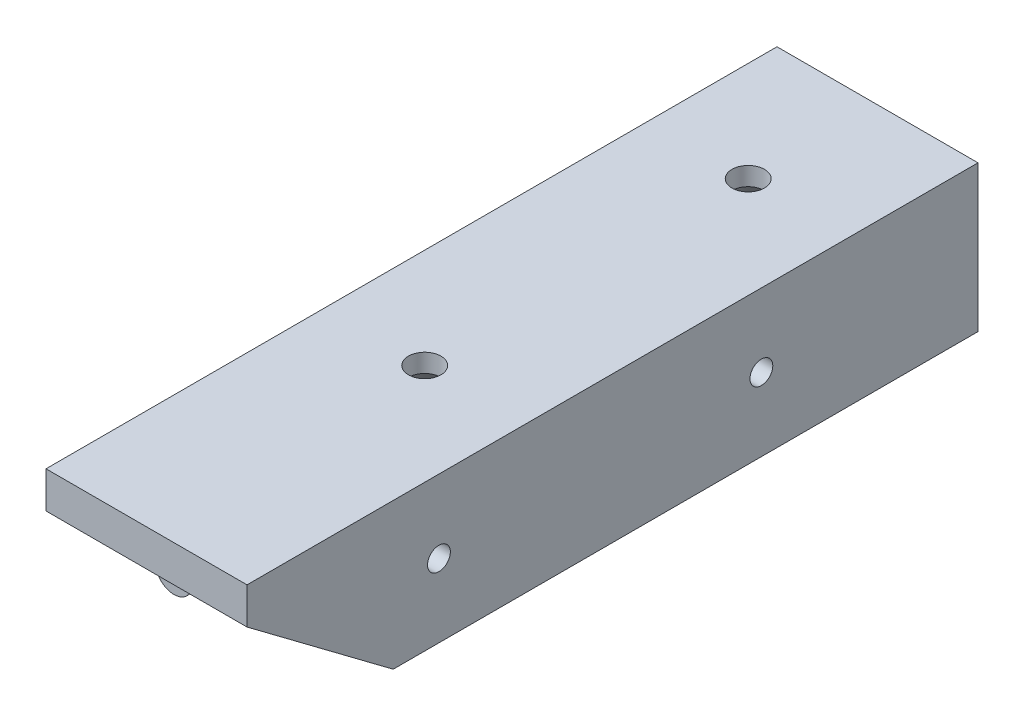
SolidWorks part; units mm, degrees
ref_plane "Front Plane" through (0, 0, 0) normal (0, 0, 1) x (1, 0, 0)
ref_plane "Top Plane" through (0, 0, 0) normal (0, 1, 0) x (1, 0, 0)
ref_plane "Right Plane" through (0, 0, 0) normal (1, 0, 0) x (0, 0, -1)
sketch "Sketch1" plane through (0, 0, 0) normal (0, 0, 1) x (1, 0, 0)
  line L0 (-33.5034, -0.7828) -> (-33.5034, 7.2172)
  line L1 (-33.5034, 7.2172) -> (-22.5034, 7.2172)
  line L2 (-22.5034, 7.2172) -> (-22.5034, -0.7828)
  line L3 (-31.5034, -0.7828) -> (-31.5034, 5.2172)
  line L4 (-31.5034, 5.2172) -> (-24.5034, 5.2172)
  line L5 (-24.5034, 5.2172) -> (-24.5034, -0.7828)
  line L6 (-33.5034, -0.7828) -> (-31.5034, -0.7828)
  line L7 (-24.5034, -0.7828) -> (-22.5034, -0.7828)
  dimension "D1" = 11
  dimension "D2" = 8
  dimension "D3" = 8
  dimension "D4" = 2
extrude "Boss-Extrude1" add sketch "Sketch1" along normal blind 40
sketch "Sketch3" plane through (-22.5034, 0, 0) normal (1, 0, 0) x (0, 0, -1)
  line L0 (-40, 7.2172) -> (-40, 5.2172) construction
  line L1 (-40, -0.7828) -> (-40, 7.2172) construction
  line L2 (-40, 5.2172) -> (-32, -0.7828) construction
  line L3 (-40, -0.7828) -> (0, -0.7828) construction
  line L4 (-40, 5.2172) -> (-40, -0.7828)
  line L5 (-40, -0.7828) -> (-32, -0.7828)
  line L6 (-32, -0.7828) -> (-40, 5.2172)
  line L7 (-40, 5.2172) -> (-29.9422, 5.1842)
  dimension "D1" = 2
  dimension "D2" = 10
extrude "Cut-Extrude1" cut sketch "Sketch3" against normal blind 15 contours L6 M6 M5
sketch "Sketch4" plane through (-22.5034, 0, 0) normal (1, 0, 0) x (0, 0, -1)
  line L0 (-30.5205, 3.2172) -> (-29.4974, 3.2172) construction
  line L1 (0, -0.7828) -> (0, 7.2172) construction
  line L2 (-32, -0.7828) -> (-40, 5.2172) construction
  line L3 (-37.3333, 3.2172) -> (-23.7077, 3.2172) construction
  line L4 (-23.7077, 3.2172) -> (0, 3.2172) construction
  circle A0 centre (-29.4974, 3.2172) radius 0.625
  circle A1 centre (-11.8539, 3.2172) radius 0.625
  dimension "D1" = 1.25
  dimension "D2" = 1.25
extrude "Cut-Extrude6" cut sketch "Sketch4" against normal blind 2
sketch "Sketch5" plane through (-33.5034, 0, 0) normal (-1, 0, 0) x (0, 0, 1)
  line L0 (30.5392, 3.2172) -> (29.4697, 3.2172) construction
  line L1 (0, 7.2172) -> (0, -0.7828) construction
  line L2 (32, -0.7828) -> (40, 5.2172) construction
  line L3 (37.3333, 3.2172) -> (23.745, 3.2172) construction
  line L4 (23.745, 3.2172) -> (0, 3.2172) construction
  circle A0 centre (11.8725, 3.2172) radius 0.625
  circle A1 centre (29.4697, 3.2172) radius 0.625
  dimension "D1" = 1.25
  dimension "D3" = 1.25
extrude "Cut-Extrude3" cut sketch "Sketch5" against normal blind 3
sketch "Sketch8" plane through (0, 5.2172, 0) normal (0, -1, 0) x (-1, 0, 0)
  circle A0 centre (28.0381, -7.0405) radius 2.5
  circle A1 centre (28.0381, -24.7423) radius 2.5
  point P7 (28.0381, -7.0405)
  dimension "D3" = 5
  dimension "D4" = 5
sketch "Sketch9" plane through (0, 5.2172, 0) normal (0, -1, 0) x (-1, 0, 0)
  line L2 (28.0034, -40) -> (28.0034, -38) construction
  line L3 (27.0034, -20) -> (29.0034, -20)
  line L4 (27.0034, -20) -> (27.0034, -21)
  line L5 (27.0034, -21) -> (29.0034, -21)
  line L6 (29.0034, -20) -> (29.0034, -21)
  line L7 (27.0034, -20) -> (29.0034, -21) construction
  line L8 (27.0034, -21) -> (29.0034, -20) construction
  line L9 (31.5034, -40) -> (24.5034, -40) construction
  line L10 (28.0034, -20) -> (28.0381, -7.0405) construction
  line L11 (27.0034, -37.5) -> (29.0034, -37.5)
  line L12 (27.0034, -37.5) -> (27.0034, -38.5)
  line L13 (27.0034, -38.5) -> (29.0034, -38.5)
  line L14 (29.0034, -37.5) -> (29.0034, -38.5)
  line L15 (27.0034, -37.5) -> (29.0034, -38.5) construction
  line L16 (27.0034, -38.5) -> (29.0034, -37.5) construction
  line L21 (29.0034, -3.3046) -> (27.0034, -3.3046)
  line L22 (29.0034, -3.3046) -> (29.0034, -2.3046)
  line L23 (29.0034, -2.3046) -> (27.0034, -2.3046)
  line L24 (27.0034, -3.3046) -> (27.0034, -2.3046)
  dimension "D2" = 1
  dimension "D3" = 2
  dimension "D4" = 2
  dimension "D5" = 2
  dimension "D6" = 1
  dimension "D7" = 2
  dimension "D8" = 1
extrude "Boss-Extrude4" add sketch "Sketch9" along normal blind 2
sketch "Sketch10" plane through (0, 0, 20) normal (0, 0, -1) x (-1, 0, 0)
  line L0 (29.0034, 4.2172) -> (29.0034, 3.2172)
  line L1 (29.0034, 3.2172) -> (29.0034, 5.2172) construction
  line L2 (29.0034, 3.2172) -> (27.0034, 3.2172)
  line L3 (27.0034, 3.2172) -> (27.0034, 4.2172)
  line L4 (27.0034, 3.2172) -> (27.0034, 5.2172) construction
  arc A0 (29.0034, 4.2172) -> (27.0034, 4.2172) centre (28.0034, 4.259) cw
sketch "Sketch13" plane through (-24.5034, 0, 0) normal (-1, 0, 0) x (0, 0, 1)
  circle A0 centre (29.4974, 3.2172) radius 0.6224
  circle A1 centre (29.4974, 3.2172) radius 1.5
  circle A2 centre (11.8539, 3.2172) radius 0.625
  circle A3 centre (11.8539, 3.2172) radius 1.5
  dimension "D1" = 3
  dimension "D2" = 3
extrude "Boss-Extrude6" add sketch "Sketch13" along normal blind 2
sketch "Sketch14" plane through (-31.5034, 0, 0) normal (1, 0, 0) x (0, 0, -1)
  circle A0 centre (-29.4697, 3.2172) radius 0.625
  circle A1 centre (-29.4697, 3.2172) radius 1.5
  circle A3 centre (-11.8725, 3.2172) radius 0.625
  circle A4 centre (-11.8725, 3.2172) radius 1.5
  dimension "D1" = 3
  dimension "D2" = 3
extrude "Boss-Extrude7" add sketch "Sketch14" along normal blind 2
hole_wizard "CSK for #0 Flat Head Socket Cap Screw2" positions "3DSketch1" profile "Sketch17" countersink size "#0" standard "ANSI Inch"
sketch3d "3DSketch1"
  point P0 (-28.0381, 5.2172, 24.7423)
  point P3 (-28.0381, 5.2172, 7.0405)
sketch "Sketch17" plane through (-28.0381, 5.2172, 24.7423) normal (1, 0, 0) x (0, 0, -1)
  line L0 (0, 0) -> (0, 2)
  line L1 (0, 2) -> (0.889, 2)
  line L2 (0.889, 2) -> (0.889, 0.9935)
  line L3 (0.889, 0.9935) -> (1.7526, 0)
  line L5 (1.7526, 0) -> (0, 0)
  line L6 (-0.889, 0.9935) -> (-1.7526, 0) construction
  line L11 (0, -6.35) -> (0, 107.95) construction
  dimension "Thru Hole Dia." = 1.778
  dimension "Thru Hole Depth" = 2
  dimension "Near C'Sink Dia." = 3.5052
  dimension "Near C'Sink Angle" = 82
extrude "Cut-Extrude7" cut sketch "Sketch10" against normal blind 20 and the other way blind 20
